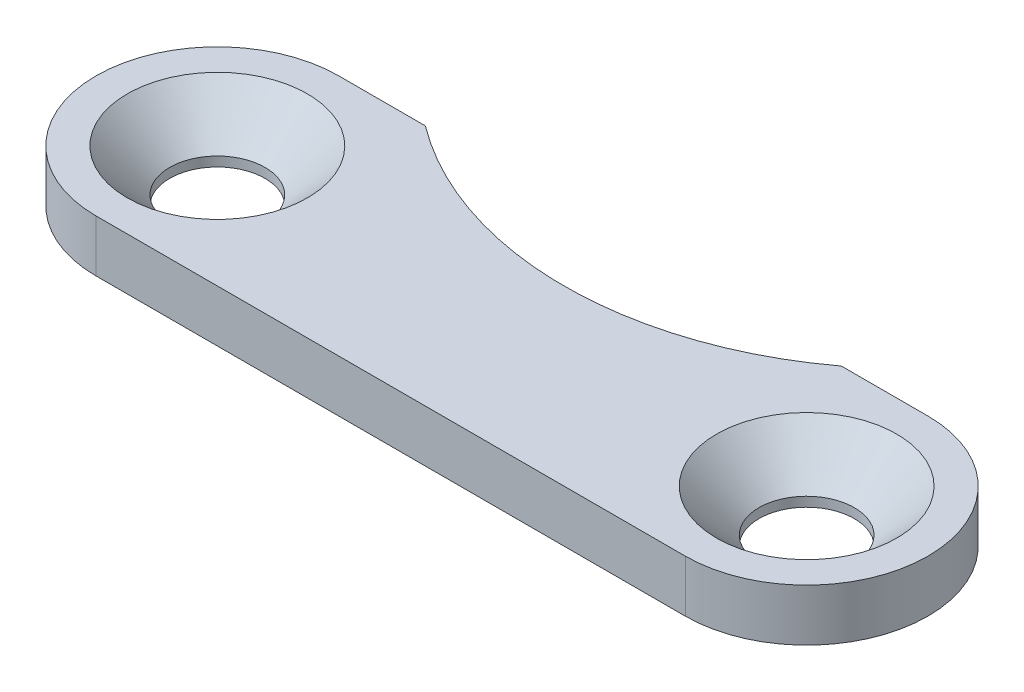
SolidWorks part; units mm, degrees
ref_plane "Front Plane" through (0, 0, 0) normal (0, 0, 1) x (1, 0, 0)
ref_plane "Top Plane" through (0, 0, 0) normal (0, 1, 0) x (1, 0, 0)
ref_plane "Right Plane" through (0, 0, 0) normal (1, 0, 0) x (0, 0, -1)
sketch "Sketch1" plane through (0, 0, 0) normal (0, 1, 0) x (1, 0, 0)
  line L0 (-17, 0) -> (17, 0) construction
  line L1 (0, 0) -> (0, 24.656) construction
  line L2 (17, -7) -> (-17, -7)
  line L3 (-17, 7) -> (-12, 7)
  line L4 (12, 7) -> (17, 7)
  arc A0 (-17, 7) -> (-17, -7) centre (-17, 0) ccw
  arc A1 (17, -7) -> (17, 7) centre (17, 0) ccw
  arc A2 (-12, 7) -> (12, 7) centre (0, 23) ccw
  dimension "D3" = 14
  dimension "D4" = 14
  dimension "D5" = 40
  dimension "D6" = 23
  dimension "D1" = 17
  dimension "D2" = 17
  dimension "D7" = 7
extrude "Extrude1" add sketch "Sketch1" along normal blind 3
sketch "Sketch2" plane through (0, 3, 0) normal (0, 1, 0) x (1, 0, 0)
  point P0 (17, 0)
  point P1 (-17, 0)
hole_wizard "CSK for M5 Countersunk Flat Head Screw1" positions "3DSketch1" profile "Sketch3" countersink size "M5" standard "ISO"
sketch3d "3DSketch1"
  point P0 (-17, 3, 0)
  point P3 (17, 3, 0)
sketch "Sketch3" plane through (-17, 3, 0) normal (1, 0, 0) x (0, 0, 1)
  line L0 (0, 0) -> (0, 3)
  line L1 (0, 3) -> (2.75, 3)
  line L2 (2.75, 3) -> (2.75, 2.45)
  line L3 (2.75, 2.45) -> (5.2, 0)
  line L5 (5.2, 0) -> (0, 0)
  line L6 (-2.75, 2.45) -> (-5.2, 0) construction
  line L11 (0, -6.35) -> (0, 107.95) construction
  dimension "Thru Hole Dia." = 5.5
  dimension "Thru Hole Depth" = 3
  dimension "Near C'Sink Dia." = 10.4
  dimension "Near C'Sink Angle" = 90
